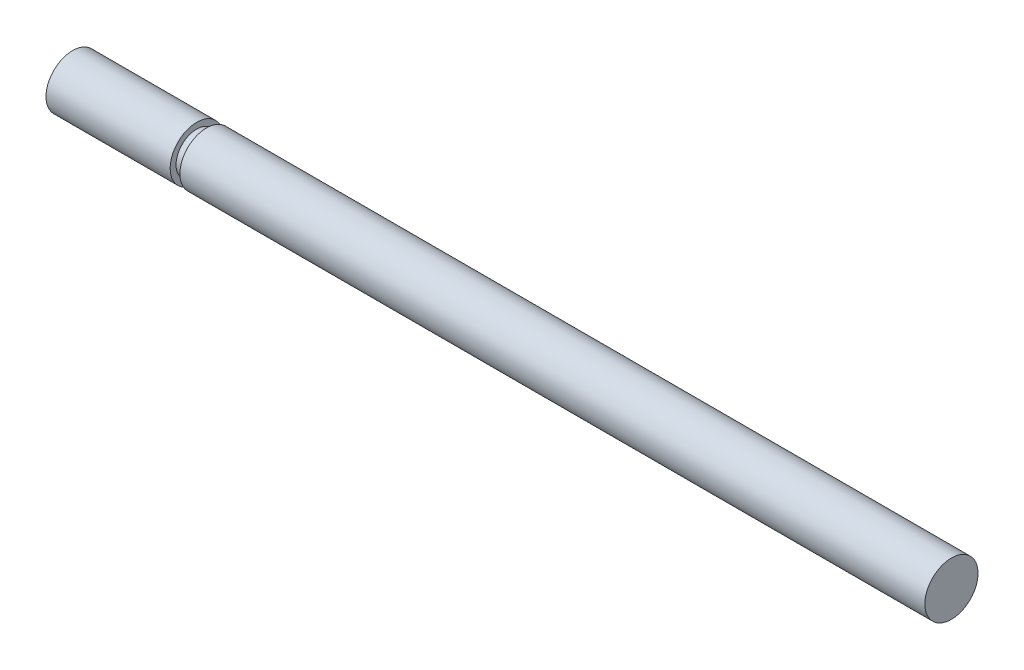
SolidWorks part; units mm, degrees
ref_plane "Front Plane" through (0, 0, 0) normal (0, 0, 1) x (1, 0, 0)
ref_plane "Top Plane" through (0, 0, 0) normal (0, 1, 0) x (1, 0, 0)
ref_plane "Right Plane" through (0, 0, 0) normal (1, 0, 0) x (0, 0, -1)
sketch "Sketch1" plane through (0, 0, 0) normal (0, 0, 1) x (1, 0, 0)
  line L0 (0, 0) -> (28.0833, 0) construction
  line L1 (1.125, 0) -> (1.125, 1.5)
  line L2 (1.125, 1.5) -> (8.125, 1.5)
  line L3 (8.125, 1.5) -> (8.125, 1.1667)
  line L4 (8.125, 1.1667) -> (8.675, 1.1667)
  line L5 (8.675, 1.1667) -> (8.675, 1.5)
  line L6 (8.675, 1.5) -> (50.675, 1.5)
  line L7 (50.675, 1.5) -> (50.675, 1.1667)
  line L8 (50.675, 1.1667) -> (51.225, 1.1667)
  line L9 (51.225, 1.1667) -> (51.225, 1.5)
  line L10 (51.225, 1.5) -> (52.225, 1.5)
  line L11 (52.225, 1.5) -> (52.225, 0)
  line L12 (1.125, 0) -> (52.225, 0)
  point P5 (52.225, 0.75)
  point P16 (1.125, 0.75)
  dimension "D1" = 1.5
  dimension "D2" = 7
  dimension "D3" = 42
  dimension "D4" = 51.1
  dimension "D5" = 0.55
  dimension "D6" = 0.55
  dimension "D7" = 1
revolve "Revolve1" add sketch "Sketch1" angle 360 about L0
sketch "Sketch2" plane through (0, 0, 0) normal (0, 0, 1) x (1, 0, 0)
  line L0 (50.675, 1.5) -> (50.675, -1.5)
extrude "Cut-Extrude1" cut sketch "Sketch2" against normal through all both and the other way through all
